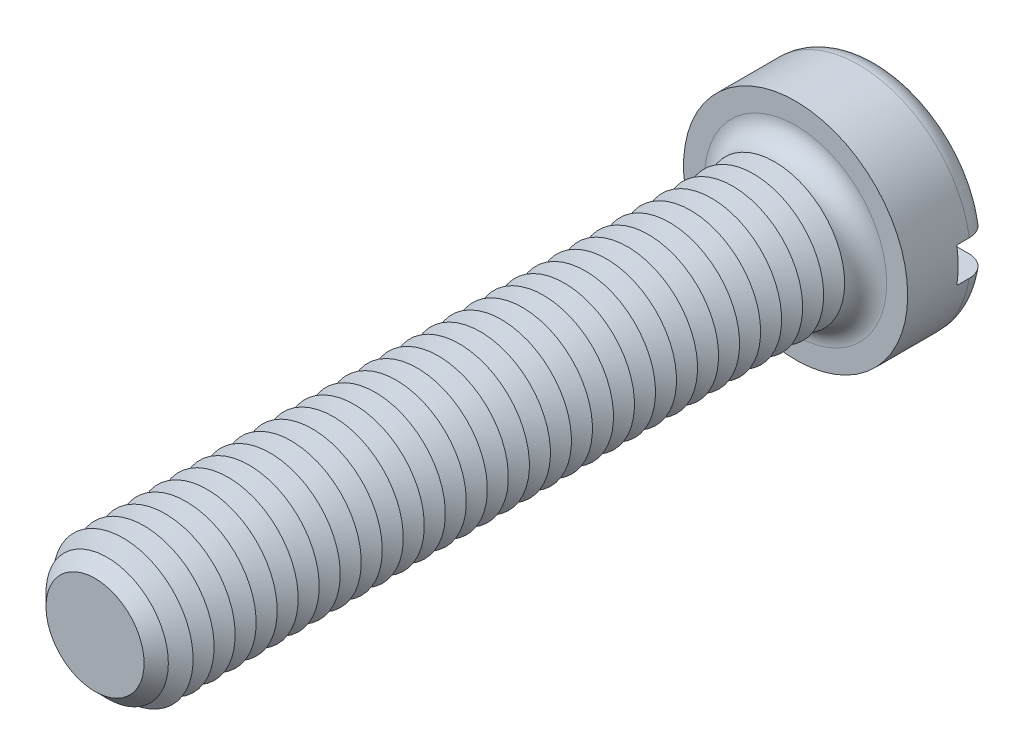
SolidWorks part; units mm, degrees
ref_plane "Front Plane" through (0, 0, 0) normal (0, 0, 1) x (1, 0, 0)
ref_plane "Top Plane" through (0, 0, 0) normal (0, 1, 0) x (1, 0, 0)
ref_plane "Right Plane" through (0, 0, 0) normal (1, 0, 0) x (0, 0, -1)
sketch "Sketch3" plane through (0, 0, 0) normal (0, 0, 1) x (1, 0, 0)
  circle A0 centre (0, 0) radius 8
  dimension "D1" = 16
extrude "Boss-Extrude2" add sketch "Sketch3" against normal blind 6
sketch "Sketch4" plane through (0, 0, 0) normal (0, 0, 1) x (1, 0, 0)
  circle A0 centre (0, 0) radius 5
  dimension "D1" = 10
extrude "Boss-Extrude3" add sketch "Sketch4" along normal blind 50
fillet "Fillet1" radius 1.5 2 edges at (8, 0, -6) (5, 0, 0)
chamfer "Chamfer1" distance 1.5 angle 45 1 edges at (5, 0, 50)
sketch "Sketch5" plane through (0, 0, 0) normal (1, 0, 0) x (0, 0, -1)
  line L0 (1.6944, 0) -> (-7.6738, 0) construction
sketch "Sketch6" plane through (0, 0, 0) normal (1, 0, 0) x (0, 0, -1)
  line L0 (-1.5, 5) -> (-2.25, 3.701)
  line L1 (-2.25, 3.701) -> (-3, 5)
  line L2 (-1.5, 5) -> (-48.5, 5) construction
  line L3 (-3, 5) -> (-1.5, 5)
  dimension "D1" = 1.5
revolve "Cut-Revolve1" cut sketch "Sketch6" angle 360 about L0
pattern_linear "LPattern1" count 32 spacing 1.5 along (0, 0, 1) of "Cut-Revolve1"
sketch "Sketch8" plane through (0, 0, -6) normal (0, 0, -1) x (-1, 0, 0)
  line L1 (8, -1.25) -> (-8, -1.25)
  line L2 (8, -1.25) -> (8, 1.25)
  line L3 (8, 1.25) -> (-8, 1.25)
  line L4 (-8, -1.25) -> (-8, 1.25)
  line L5 (8, -1.25) -> (-8, 1.25) construction
  line L6 (8, 1.25) -> (-8, -1.25) construction
  point P0 (0, 0)
  dimension "D1" = 16
  dimension "D2" = 2.5
extrude "Cut-Extrude1" cut sketch "Sketch8" against normal blind 2.4
